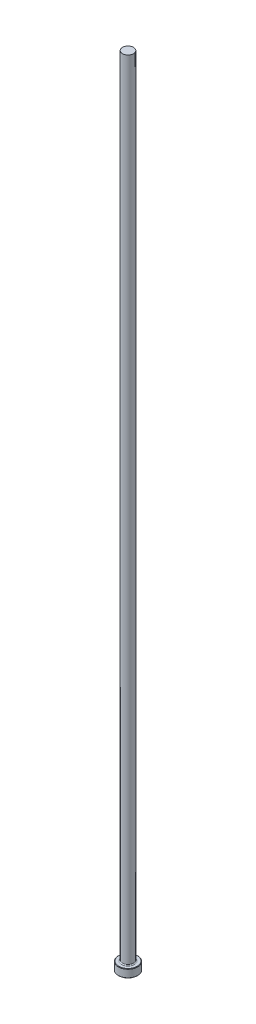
SolidWorks part; units mm, degrees
ref_plane "Front Plane" through (0, 0, 0) normal (0, 0, 1) x (1, 0, 0)
ref_plane "Top Plane" through (0, 0, 0) normal (0, 1, 0) x (1, 0, 0)
ref_plane "Right Plane" through (0, 0, 0) normal (1, 0, 0) x (0, 0, -1)
sketch "Sketch1" plane through (0, 0, 0) normal (0, 0, 1) x (1, 0, 0)
  line L0 (0, 259.9588) -> (0, -15.1925) construction
  line L1 (0, 0) -> (-5.5499, 0)
  line L2 (-5.5499, 0) -> (-5.5499, 4.7498)
  line L3 (-5.5499, 4.7498) -> (-3.175, 4.7498)
  line L4 (-3.175, 4.7498) -> (-3.175, 457.2)
  line L5 (-3.175, 457.2) -> (0, 457.2)
  line L6 (0, 457.2) -> (0, 0)
  dimension "L" = 457.2
  dimension "H" = 11.0998
  dimension "T" = 4.7498
  dimension "D" = 6.35
revolve "Revolve1" add sketch "Sketch1" angle 360 about L0
chamfer "Chamfer1" distance 0.254 angle 45 2 edges at (0, 4.7498, 5.5499) (0, 0, 5.5499)
fillet "Fillet1" radius 0.508 1 edges at (0, 4.7498, 3.175)
sketch "Pocket Sketch" plane through (0, 0, 0) normal (0, 0, 1) x (1, 0, 0)
  line L0 (-5.9468, 0) -> (-5.9468, 4.7752)
  line L1 (-5.9468, 4.7752) -> (-4.3339, 4.7752)
  line L2 (-3.5719, 5.5372) -> (-3.5719, 22.225)
  line L3 (-3.5719, 22.225) -> (0, 22.225)
  line L4 (0, 22.225) -> (0, 0)
  line L5 (0, 0) -> (-5.9468, 0)
  line L6 (0, 12.6104) -> (0, -2.4989) construction
  line L7 (-5.5499, 4.4958) -> (-5.5499, 0.254) construction
  line L8 (5.2959, 4.7498) -> (-5.2959, 4.7498) construction
  line L9 (-3.175, 457.2) -> (-3.175, 5.2578) construction
  line L10 (-4.3339, 4.7752) -> (-3.5719, 5.5372)
  point P3 (-3.5719, 4.7752)
  dimension "D1" = 11.8935
  dimension "D2" = 0.3969
  dimension "D3" = 0.0254
  dimension "D4" = 0.3969
  dimension "D5" = 7.1437
  dimension "D6" = 22.225
